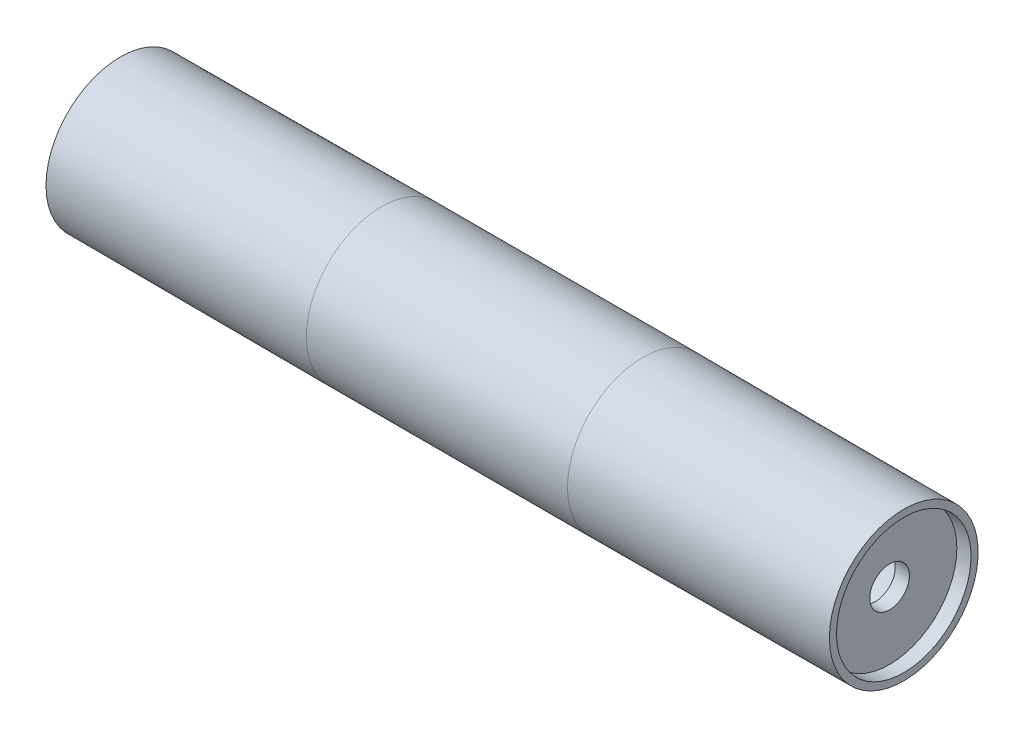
SolidWorks part; units mm, degrees
other "Objet de détail1"
extrude "Boss.-Extru.1" add sketch "Esquisse2" against normal blind 25
sketch "Esquisse2" plane through (665, 0, 0) normal (1, 0, 0) x (0, 0, -1)
  circle A0 centre (0, 0) radius 119
  dimension "D1" = 238
revolve "Base-Révolution" add sketch "Esquisse1" angle 360 about L2
sketch "Esquisse1" plane through (0, 0, 0) normal (0, 0, 1) x (1, 0, 0)
  line L0 (690, -118.5) -> (690, -131)
  line L1 (-690, -118.5) -> (690, -118.5)
  line L2 (-457.4953, 0) -> (463.504, 0) construction
  line L6 (-690, -118.5) -> (-690, -131)
  line L7 (-230, -132.5) -> (230, -132.5)
  line L12 (230, -132.5) -> (690, -131)
  line L13 (-690, -131) -> (-230, -132.5)
  dimension "D2" = 132.5
  dimension "D3" = 131
  dimension "D4" = 460
  dimension "D7" = 131
  dimension "D9" = 460
  dimension "D10" = 690
  dimension "D13" = 460
  dimension "D14" = 118.5
other "Objet de détail2"
mirror "Symétrie1" about plane through (0, 0, 0) normal (1, 0, 0) of "Boss.-Extru.1"
ref_plane "Front" through (0, 0, 0) normal (0, 0, 1) x (1, 0, 0)
ref_plane "Top" through (0, 0, 0) normal (0, 1, 0) x (1, 0, 0)
ref_plane "Right" through (0, 0, 0) normal (1, 0, 0) x (0, 0, -1)
ref_plane "Plan1" through (665, 0, 0) normal (1, 0, 0) x (0, 0, -1)
sketch "Esquisse3" plane through (665, 0, 0) normal (1, 0, 0) x (0, 0, -1)
  circle A0 centre (0, 0) radius 35
  dimension "D1" = 70
extrude "Enlèv. mat.-Extru.1" cut sketch "Esquisse3" against normal through all
